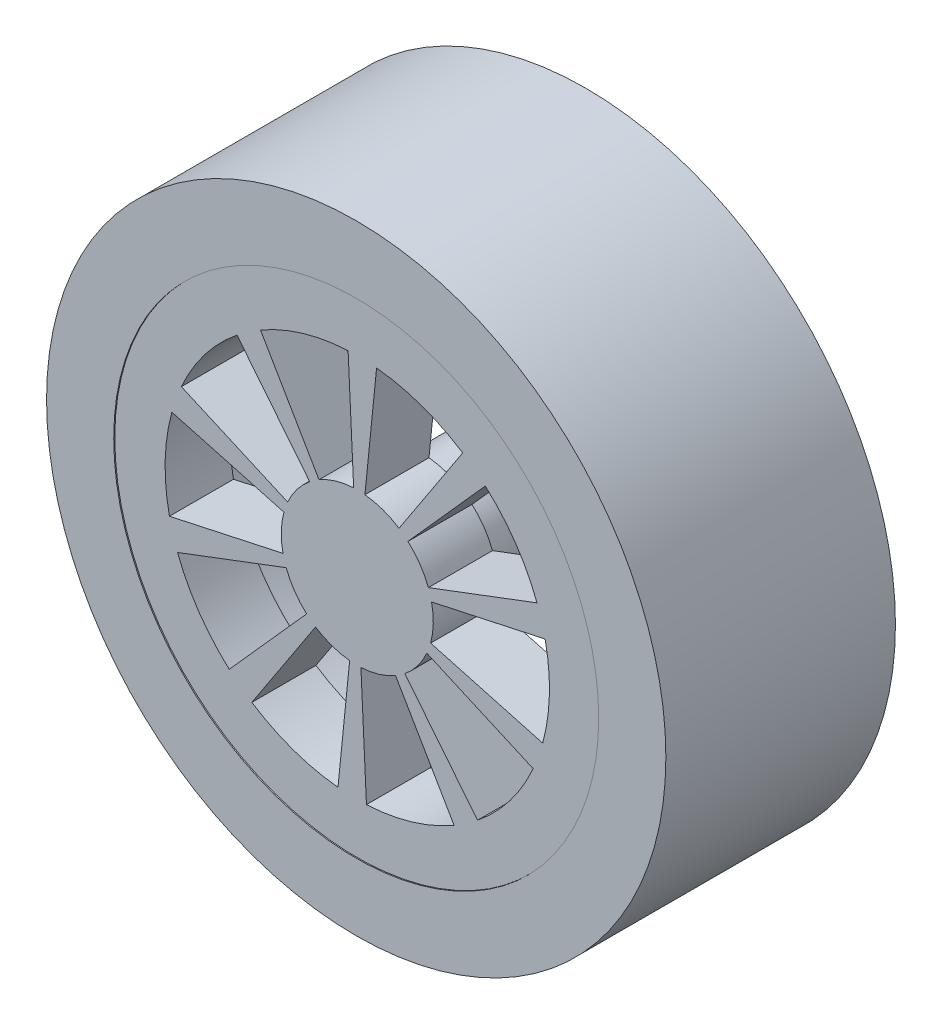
SolidWorks part; units mm, degrees
ref_plane "Front Plane" through (0, 0, 0) normal (0, 0, 1) x (1, 0, 0)
ref_plane "Top Plane" through (0, 0, 0) normal (0, 1, 0) x (1, 0, 0)
ref_plane "Right Plane" through (0, 0, 0) normal (1, 0, 0) x (0, 0, -1)
sketch "Sketch2" plane through (0, 0, 0) normal (0, 0, 1) x (1, 0, 0)
  circle A0 centre (0, 0) radius 14.5
  circle A1 centre (0, 0) radius 11.355
  dimension "D1" = 29
  dimension "D2" = 22.71
extrude "Boss-Extrude1" add sketch "Sketch2" along normal blind 10.75
sketch "Sketch6" plane through (0, 0, 10.75) normal (0, 0, 1) x (1, 0, 0)
  circle A0 centre (0, 0) radius 11.355
  circle A1 centre (0, 0) radius 14.5 construction
  dimension "D1" = 22.71
extrude "Boss-Extrude2" add sketch "Sketch6" against normal blind 3 from offset 0.05 separate body
sketch "Sketch7" plane through (0, 0, 10.7) normal (0, 0, 1) x (1, 0, 0)
  line L0 (-4.5319, 7.7757) -> (-1.7926, 3.0757)
  line L1 (-0.1698, 3.5559) -> (-0.4294, 8.9898)
  arc A0 (-1.7926, 3.0757) -> (-0.1698, 3.5559) centre (0, 0) cw
  arc A1 (-0.4294, 8.9898) -> (-4.5319, 7.7757) centre (0, 0) ccw
  point P4 (-1.0888, 3.1152)
  point P6 (0, 0)
  point P7 (0, 0)
  dimension "D1" = 27.5
  dimension "D2" = 9
  dimension "D3" = 3.56
  dimension "D4" = 4.7
extrude "Cut-Extrude1" cut sketch "Sketch7" against normal up to surface (3 mm away)
pattern_circular "CirPattern1" count 10 over 360 about axis through (0, 0, 0) along (0, 0, 1) of "Cut-Extrude1"
sketch "Sketch8" plane through (0, 0, 7.7) normal (0, 0, -1) x (-1, 0, 0)
  circle A0 centre (0, 0) radius 2.715
  circle A1 centre (0, 0) radius 1.025
  dimension "D1" = 5.43
  dimension "D2" = 2.05
extrude "Boss-Extrude3" add sketch "Sketch8" along normal up to surface (7.7 mm away)
